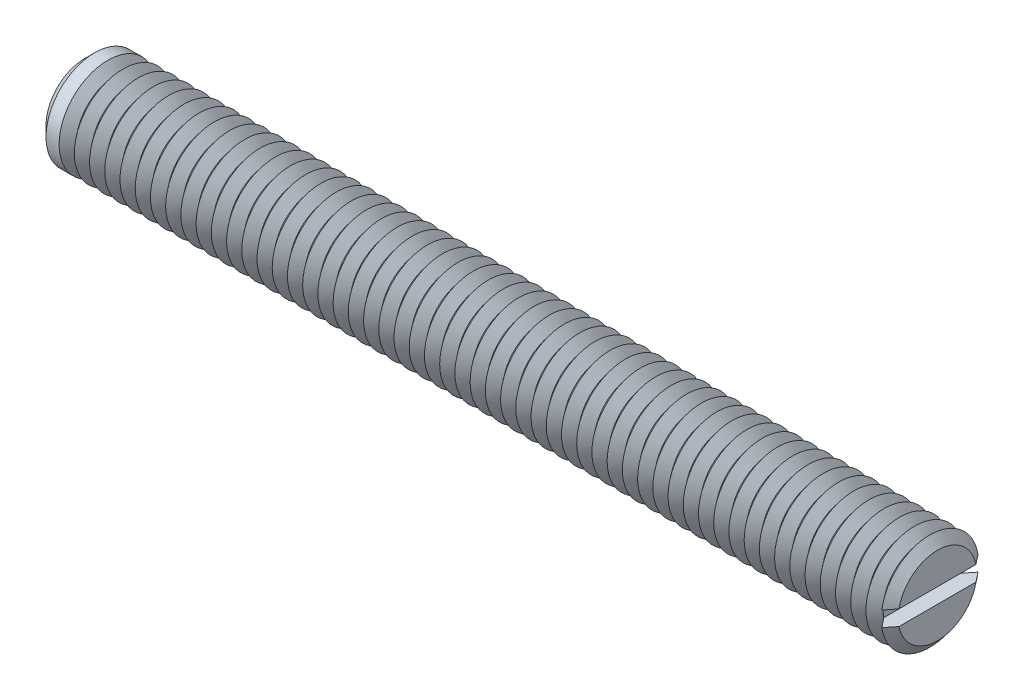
SolidWorks part; units mm, degrees
ref_plane "Front Plane" through (0, 0, 0) normal (0, 0, 1) x (1, 0, 0)
ref_plane "Top Plane" through (0, 0, 0) normal (0, 1, 0) x (1, 0, 0)
ref_plane "Right Plane" through (0, 0, 0) normal (1, 0, 0) x (0, 0, -1)
sketch "Sketch1" plane through (0, 0, 0) normal (1, 0, 0) x (0, 0, -1)
  circle A0 centre (0, 0) radius 4
  dimension "D1" = 8
extrude "Extrude1" add sketch "Sketch1" along normal mid plane 70
sketch "Sketch2" plane through (0, 0, 0) normal (0, 0, 1) x (1, 0, 0)
  line L0 (35, 0.625) -> (33.75, 0.625)
  line L1 (35, -4) -> (35, 4) construction
  line L2 (33.75, 0.625) -> (33.75, -0.625)
  line L3 (0, 0) -> (50000, 0) construction
  line L4 (35, -0.625) -> (33.75, -0.625)
  line L5 (35, -0.625) -> (35, 0.625)
  point P9 (33.75, 0)
  dimension "D1" = 1.25
extrude "Extrude2" cut sketch "Sketch2" against normal mid plane 12
chamfer "Chamfer1" distance 0.8 angle 45 1 edges at (-35, 0, -4)
sketch "Sketch3" plane through (0, 0, 0) normal (0, 0, 1) x (1, 0, 0)
  line L0 (0, 0) -> (30.9602, 0) construction
  line L1 (34.375, -4) -> (35.625, -4)
  line L2 (-34.2, -4) -> (35, -4) construction
  line L3 (35.625, -4) -> (35, -3.2194)
  line L4 (35, -4) -> (35, -0.625) construction
  line L5 (35, -3.2194) -> (34.375, -4)
  dimension "D1" = 1.25
  dimension "D2" = 1
revolve "Cut-Revolve1" cut sketch "Sketch3" angle 360 about L0
pattern_linear "LPattern1" count 55 spacing 1.25 along (-1, 0, 0) of "Cut-Revolve1"
equation "\"D2@Sketch3\" = \"D1@Sketch3\"*0.8"
